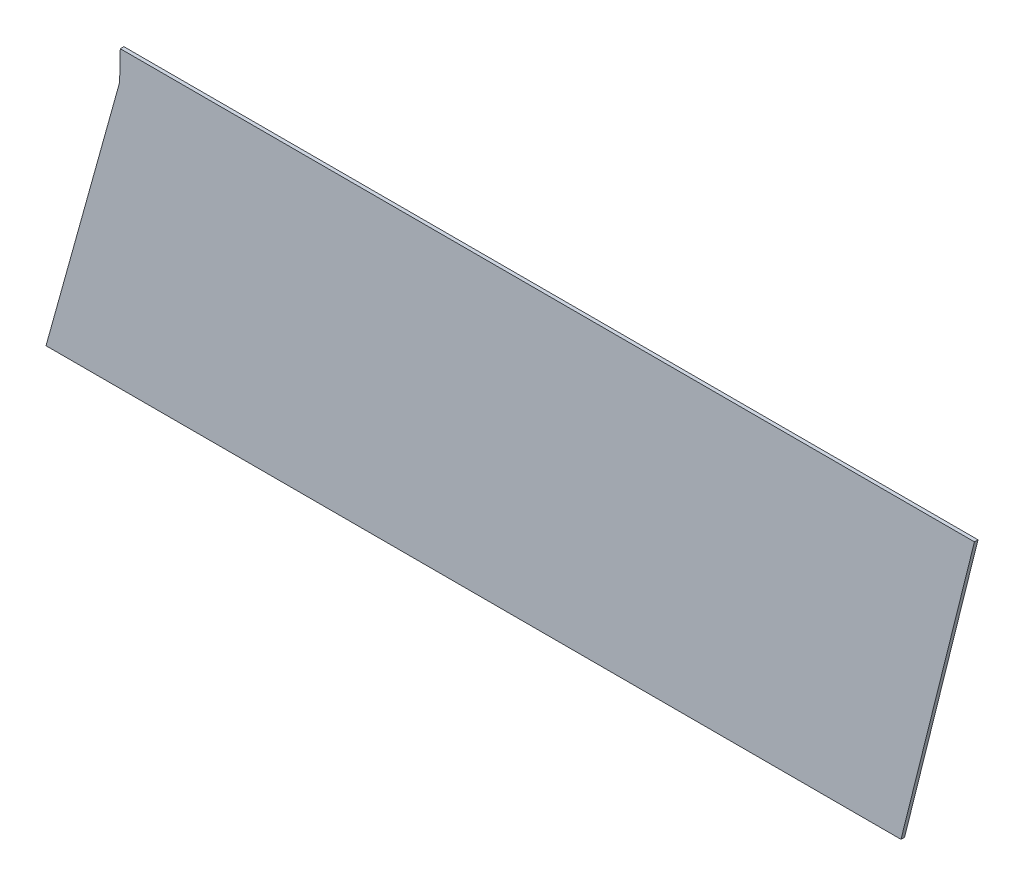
SolidWorks part; units mm, degrees
ref_plane "Face" through (0, 0, 0) normal (0, 0, 1) x (1, 0, 0)
ref_plane "Dessus" through (0, 0, 0) normal (0, 1, 0) x (1, 0, 0)
ref_plane "Droite" through (0, 0, 0) normal (1, 0, 0) x (0, 0, -1)
mirrored part "plaque de protection coté_Rendre symétrique"
other "<plaque de protection coté>-<Base-Extrusion>"
